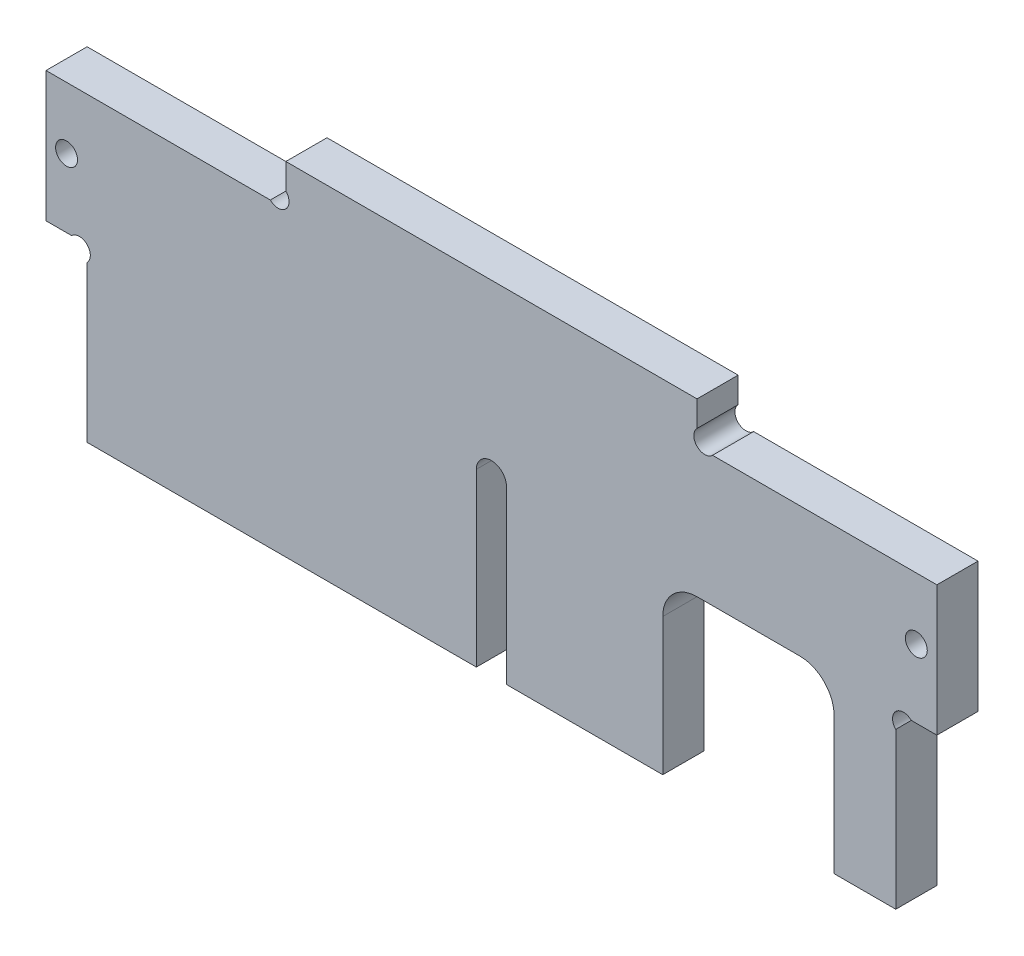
SolidWorks part; units mm, degrees
ref_plane "Plan de face" through (0, 0, 0) normal (0, 0, 1) x (1, 0, 0)
ref_plane "Plan de dessus" through (0, 0, 0) normal (0, 1, 0) x (1, 0, 0)
ref_plane "Plan de droite" through (0, 0, 0) normal (1, 0, 0) x (0, 0, -1)
sketch "Esquisse1" plane through (0, 0, 0) normal (0, 0, 1) x (1, 0, 0)
  line L0 (0, -5.3425) -> (0, 69.7724) construction
  line L1 (-53.7752, 0) -> (81.3864, 0) construction
  line L2 (-53.7752, 50) -> (81.3864, 50) construction
  line L3 (65, -11.91) -> (65, 77.9943) construction
  line L4 (-65, -5.3425) -> (-65, 79.3023) construction
  line L5 (74.3589, 44) -> (-10.6104, 44) construction
  line L6 (30, 62.1112) -> (30, 42.1171) construction
  line L7 (59, 62.1112) -> (59, -2.7862) construction
  line L8 (77.325, 25) -> (-52.8767, 25) construction
  line L9 (62, 39.1273) -> (62, 33.0146) construction
  line L10 (74.3589, 35) -> (41.15, 35) construction
  line L11 (30, 44) -> (42.0233, 56.0233) construction
  line L12 (59, 25) -> (68.2711, 15.7289) construction
  line L13 (30, 46.2627) -> (30, 50)
  line L14 (32.2627, 44) -> (65, 44)
  line L15 (65, 44) -> (65, 25)
  line L16 (65, 25) -> (61.2627, 25)
  line L17 (59, 22.7373) -> (59, 0)
  line L18 (-59, 22.7373) -> (-59, 0)
  line L19 (-65, 25) -> (-61.2627, 25)
  line L20 (-65, 44) -> (-65, 25)
  line L21 (-32.2627, 44) -> (-65, 44)
  line L22 (-30, 46.2627) -> (-30, 50)
  line L23 (-30, 50) -> (30, 50)
  line L24 (-59, 0) -> (-2.2, 0)
  line L25 (-2.2, 25) -> (-2.2, 0)
  line L26 (2.2, 25) -> (2.2, 0)
  line L27 (2.2, 0) -> (25, 0)
  line L28 (50, -11.91) -> (50, 30.2531) construction
  line L29 (25, -11.91) -> (25, 30.2531) construction
  line L30 (50, 0) -> (59, 0)
  line L34 (25, 20) -> (25, 0)
  line L35 (45, 25) -> (30, 25)
  line L36 (50, 0) -> (50, 20)
  circle A0 centre (62, 35) radius 1.6
  arc A1 (30, 46.2627) -> (32.2627, 44) centre (31.1314, 45.1314) ccw
  arc A2 (61.2627, 25) -> (59, 22.7373) centre (60.1314, 23.8686) ccw
  arc A3 (-61.2627, 25) -> (-59, 22.7373) centre (-60.1314, 23.8686) cw
  arc A4 (-30, 46.2627) -> (-32.2627, 44) centre (-31.1314, 45.1314) cw
  circle A5 centre (-62, 35) radius 1.6
  arc A6 (2.2, 25) -> (-2.2, 25) centre (0, 25) ccw
  arc A9 (30, 25) -> (25, 20) centre (30, 20) ccw
  arc A10 (50, 20) -> (45, 25) centre (45, 20) ccw
  point P66 (-25, 25)
  point P69 (-50, 25)
  dimension "D12" = 15
  dimension "D1" = 50
  dimension "D2" = 130
  dimension "D3" = 65
  dimension "D4" = 6
  dimension "D5" = 25
  dimension "D6" = 6
  dimension "D7" = 30
  dimension "D8" = 10
  dimension "D9" = 3
  dimension "D10" = 45
  dimension "D11" = 45
  dimension "D13" = 25
extrude "Boss.-Extru.1" add sketch "Esquisse1" along normal blind 6
